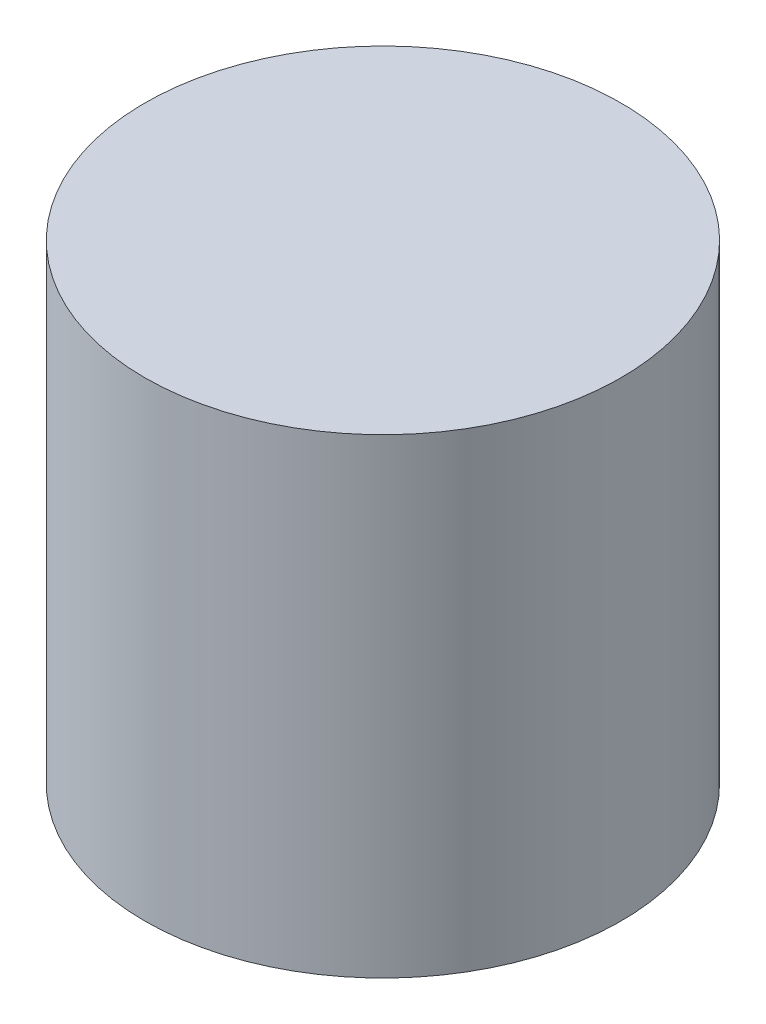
SolidWorks part; units mm, degrees
ref_plane "Front Plane" through (0, 0, 0) normal (0, 0, 1) x (1, 0, 0)
ref_plane "Top Plane" through (0, 0, 0) normal (0, 1, 0) x (1, 0, 0)
ref_plane "Right Plane" through (0, 0, 0) normal (1, 0, 0) x (0, 0, -1)
sketch "Sketch1" plane through (0, 0, 0) normal (0, 1, 0) x (1, 0, 0)
  circle A0 centre (0, 0) radius 10.922
  dimension "D1" = 21.844
extrude "Boss-Extrude1" add sketch "Sketch1" along normal blind 21.59
